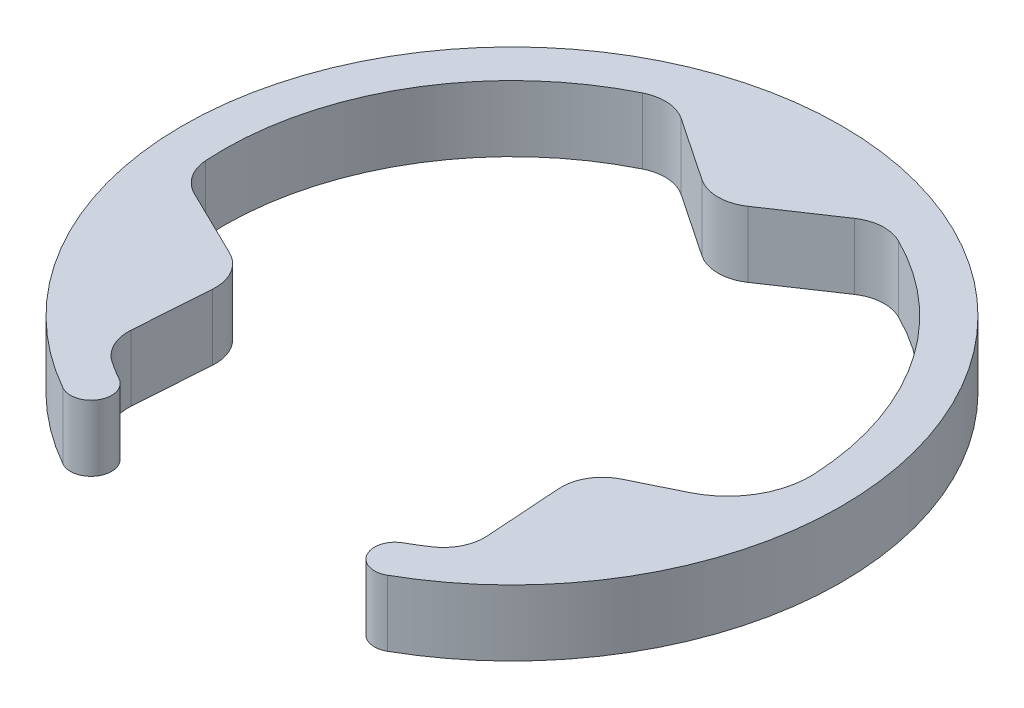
SolidWorks part; units mm, degrees
ref_plane "Plan de face" through (0, 0, 0) normal (0, 0, 1) x (1, 0, 0)
ref_plane "Plan de dessus" through (0, 0, 0) normal (0, 1, 0) x (1, 0, 0)
ref_plane "Plan de droite" through (0, 0, 0) normal (1, 0, 0) x (0, 0, -1)
ref_plane "Plan1" through (0, 0.8, 0) normal (0, 1, 0) x (1, 0, 0)
sketch "Esquisse1" plane through (0, 0.8, 0) normal (0, 1, 0) x (1, 0, 0)
  line L0 (-2.1628, -2.4621) -> (-2.0992, -1.5342)
  line L1 (-2.3782, -1.0509) -> (-3.2136, -0.642)
  line L2 (-1.0508, 3.1041) -> (-0.279, 2.5851)
  line L3 (0.279, 2.5851) -> (1.0508, 3.1041)
  line L4 (2.9368, -0.7775) -> (2.3782, -1.0509)
  line L5 (2.0992, -1.5342) -> (2.1628, -2.4621)
  arc A0 (2.1628, -2.4621) -> (1.9413, -2.9123) centre (1.6639, -2.4963) cw
  arc A1 (1.9413, -2.9123) -> (1.7224, -3.0469) centre (0, 0) cw
  arc A2 (1.7224, -3.0469) -> (1.9684, -3.4821) centre (1.8454, -3.2645) ccw
  arc A3 (1.9684, -3.4821) -> (-1.9684, -3.4821) centre (0, 0) ccw
  arc A4 (-1.9684, -3.4821) -> (-1.7224, -3.0469) centre (-1.8454, -3.2645) ccw
  arc A5 (-1.7224, -3.0469) -> (-1.9413, -2.9123) centre (0, 0) cw
  arc A6 (-1.9413, -2.9123) -> (-2.1628, -2.4621) centre (-1.6639, -2.4963) cw
  arc A7 (-2.0992, -1.5342) -> (-2.3782, -1.0509) centre (-2.5981, -1.5) ccw
  arc A8 (-3.2136, -0.642) -> (-3.4928, -0.225) centre (-2.9938, -0.1929) cw
  arc A9 (-3.4928, -0.225) -> (-1.5515, 3.1373) centre (0, 0) cw
  arc A10 (-1.5515, 3.1373) -> (-1.0508, 3.1041) centre (-1.3298, 2.6891) cw
  arc A11 (-0.279, 2.5851) -> (0.279, 2.5851) centre (0, 3) ccw
  arc A12 (1.0508, 3.1041) -> (1.5515, 3.1373) centre (1.3298, 2.6891) cw
  arc A13 (1.5515, 3.1373) -> (3.4959, 0.1689) centre (0, 0) cw
  arc A14 (3.4959, 0.1689) -> (2.9368, -0.7775) centre (2.4971, 0.1206) cw
  arc A15 (2.3782, -1.0509) -> (2.0992, -1.5342) centre (2.5981, -1.5) ccw
extrude "Boss.-Extru.1" add sketch "Esquisse1" against normal blind 0.8
